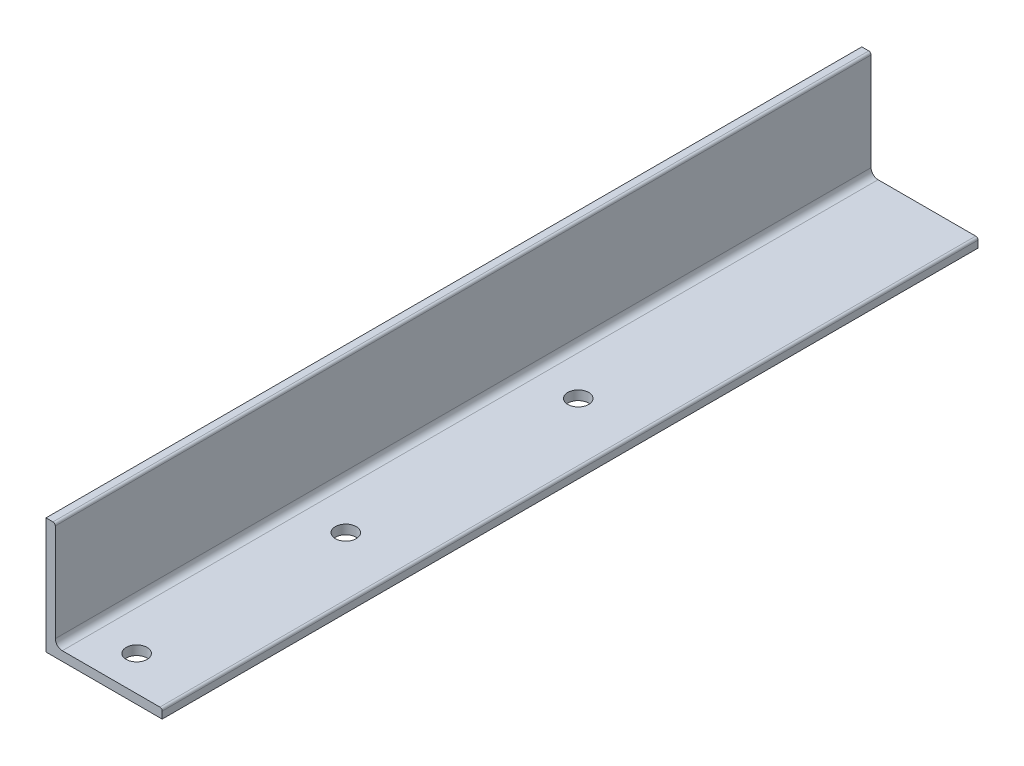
SolidWorks part; units mm, degrees
other "<10YSQ-00-36N>-<LPattern2>"
ref_plane "Front Plane" through (0, 0, 0) normal (0, 0, 1) x (1, 0, 0)
ref_plane "Top Plane" through (0, 0, 0) normal (0, 1, 0) x (1, 0, 0)
ref_plane "Right Plane" through (0, 0, 0) normal (1, 0, 0) x (0, 0, -1)
mirrored part "10YSQ-00-36N_Mirrored"
